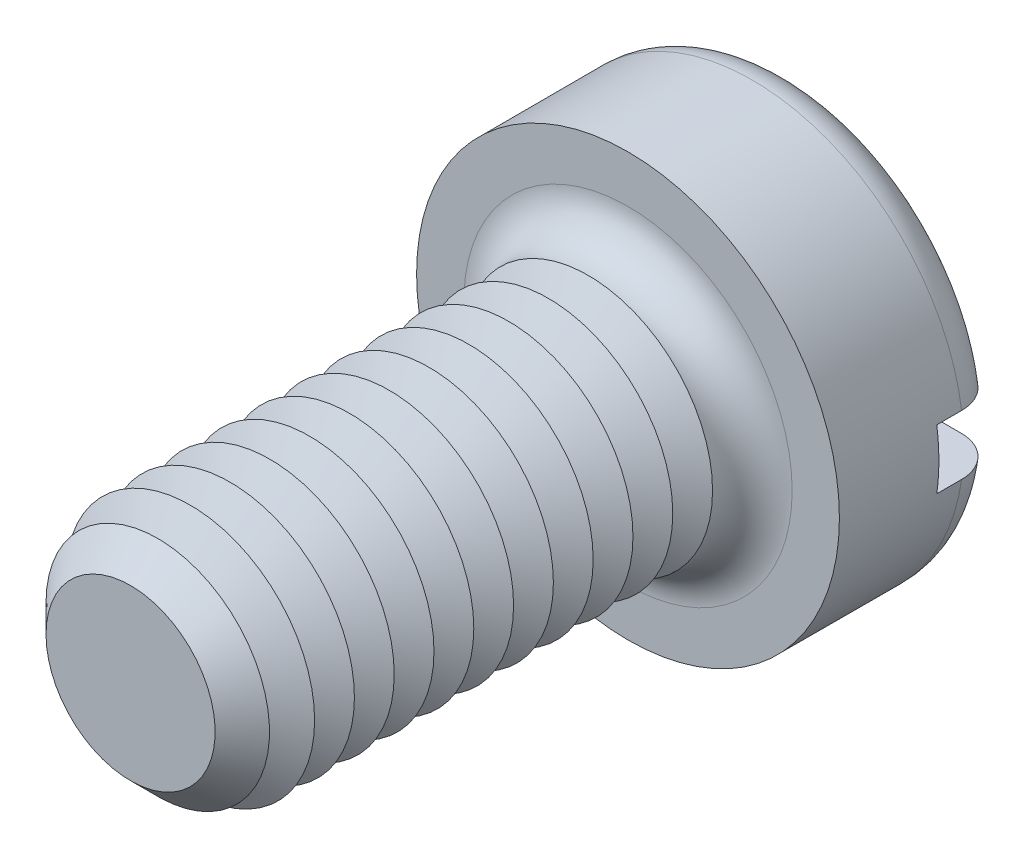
SolidWorks part; units mm, degrees
ref_plane "Front Plane" through (0, 0, 0) normal (0, 0, 1) x (1, 0, 0)
ref_plane "Top Plane" through (0, 0, 0) normal (0, 1, 0) x (1, 0, 0)
ref_plane "Right Plane" through (0, 0, 0) normal (1, 0, 0) x (0, 0, -1)
sketch "Sketch3" plane through (0, 0, 0) normal (0, 0, 1) x (1, 0, 0)
  circle A0 centre (0, 0) radius 4.25
  dimension "D1" = 8.5
extrude "Boss-Extrude2" add sketch "Sketch3" against normal blind 3.3
sketch "Sketch4" plane through (0, 0, 0) normal (0, 0, 1) x (1, 0, 0)
  circle A0 centre (0, 0) radius 2.5
  dimension "D1" = 5
extrude "Boss-Extrude3" add sketch "Sketch4" along normal blind 10
fillet "Fillet1" radius 0.8 2 edges at (4.25, 0, -3.3) (2.5, 0, 0)
chamfer "Chamfer1" distance 0.8 angle 45 1 edges at (2.5, 0, 10)
sketch "Sketch5" plane through (0, 0, 0) normal (1, 0, 0) x (0, 0, -1)
  line L0 (1.6944, 0) -> (-7.6738, 0) construction
sketch "Sketch6" plane through (0, 0, 0) normal (1, 0, 0) x (0, 0, -1)
  line L0 (-0.8, 2.5) -> (-1.2, 1.8072)
  line L1 (-1.2, 1.8072) -> (-1.6, 2.5)
  line L2 (-0.8, 2.5) -> (-9.2, 2.5) construction
  line L3 (-1.6, 2.5) -> (-0.8, 2.5)
  dimension "D1" = 0.8
revolve "Cut-Revolve1" cut sketch "Sketch6" angle 360 about L0
pattern_linear "LPattern1" count 11 spacing 0.8 along (0, 0, 1) of "Cut-Revolve1"
sketch "Sketch8" plane through (0, 0, -3.3) normal (0, 0, -1) x (-1, 0, 0)
  line L1 (4.25, -0.6) -> (-4.25, -0.6)
  line L2 (4.25, -0.6) -> (4.25, 0.6)
  line L3 (4.25, 0.6) -> (-4.25, 0.6)
  line L4 (-4.25, -0.6) -> (-4.25, 0.6)
  line L5 (4.25, -0.6) -> (-4.25, 0.6) construction
  line L6 (4.25, 0.6) -> (-4.25, -0.6) construction
  point P0 (0, 0)
  dimension "D1" = 8.5
  dimension "D2" = 1.2
extrude "Cut-Extrude1" cut sketch "Sketch8" against normal blind 1.3
